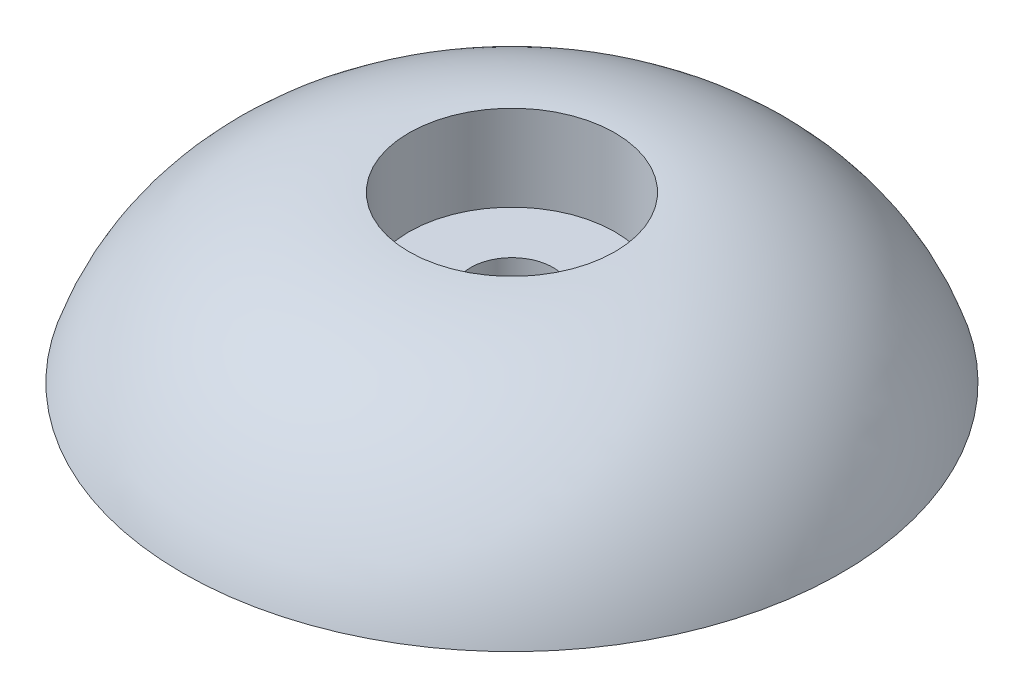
SolidWorks part; units mm, degrees
ref_plane "Front" through (0, 0, 0) normal (0, 0, 1) x (1, 0, 0)
ref_plane "Top" through (0, 0, 0) normal (0, 1, 0) x (1, 0, 0)
ref_plane "Right" through (0, 0, 0) normal (1, 0, 0) x (0, 0, -1)
sketch "Sketch1" plane through (0, 0, 0) normal (1, 0, 0) x (0, 0, -1)
  line L0 (6.35, 0) -> (6.35, 12.192)
  line L1 (6.35, 12.192) -> (15.875, 12.192)
  line L2 (15.875, 12.192) -> (15.875, 25.4)
  line L3 (50.8, 0) -> (6.35, 0)
  line L4 (0, 0) -> (0, -14014.9092) construction
  arc A0 (15.875, 25.4) -> (50.8, 0) centre (15.875, -11.3109) cw
  dimension "D1" = 12.7
  dimension "D2" = 25.4
  dimension "D3" = 101.6
  dimension "D4" = 12.192
  dimension "D5" = 31.75
revolve "Revolve1" add sketch "Sketch1" angle 360 about L4
